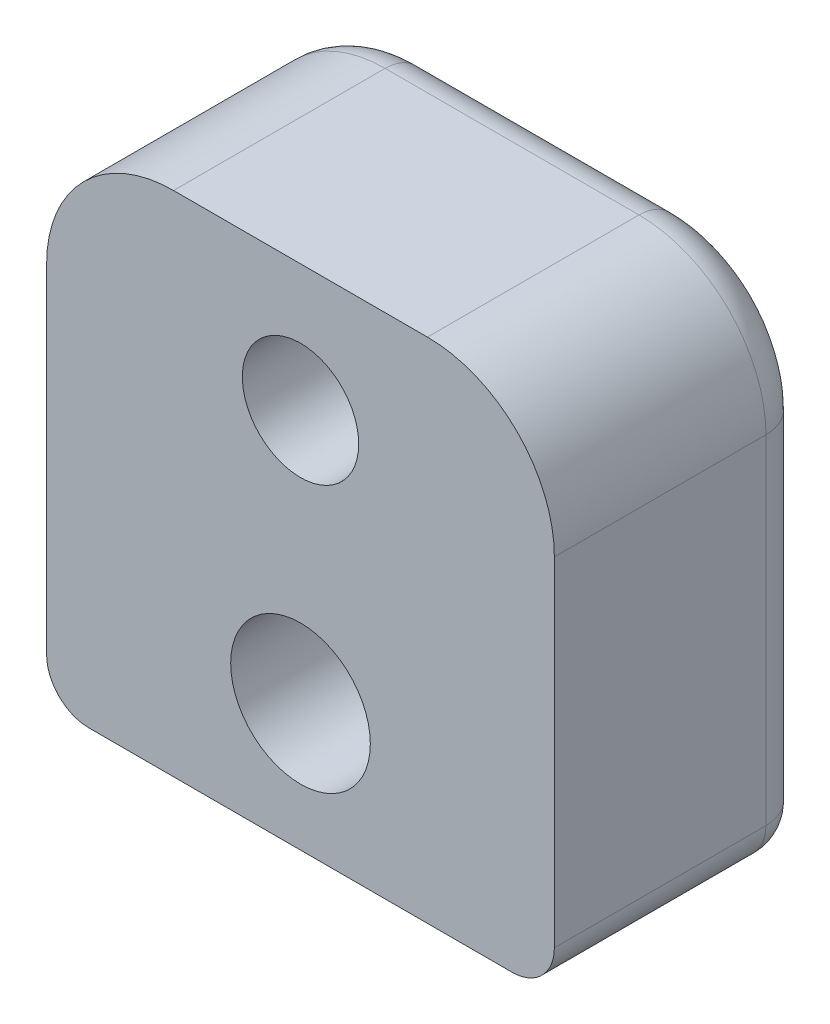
SolidWorks part; units mm, degrees
ref_plane "Front Plane" through (0, 0, 0) normal (0, 0, 1) x (1, 0, 0)
ref_plane "Top Plane" through (0, 0, 0) normal (0, 1, 0) x (1, 0, 0)
ref_plane "Right Plane" through (0, 0, 0) normal (1, 0, 0) x (0, 0, -1)
sketch "Sketch1" plane through (0, 0, 0) normal (0, 0, 1) x (1, 0, 0)
  line L0 (0.8125, -14.1875) -> (0.8125, 9.8125) construction
  line L1 (-5.1875, 9.8125) -> (6.8125, 9.8125)
  line L2 (-11.1875, 3.8125) -> (-11.1875, -12.1875)
  line L3 (-9.1875, -14.1875) -> (10.8125, -14.1875)
  line L4 (12.8125, 3.8125) -> (12.8125, -12.1875)
  line L5 (-11.1875, -8.1875) -> (12.8125, -8.1875) construction
  line L6 (-11.1875, 3.8125) -> (12.8125, 3.8125) construction
  arc A0 (6.8125, 9.8125) -> (12.8125, 3.8125) centre (6.8125, 3.8125) cw
  arc A1 (-5.1875, 9.8125) -> (-11.1875, 3.8125) centre (-5.1875, 3.8125) ccw
  arc A2 (10.8125, -14.1875) -> (12.8125, -12.1875) centre (10.8125, -12.1875) ccw
  arc A3 (-11.1875, -12.1875) -> (-9.1875, -14.1875) centre (-9.1875, -12.1875) ccw
  circle A4 centre (0.8125, -8.1875) radius 3.3
  circle A5 centre (0.8125, 3.8125) radius 2.75
  dimension "D3" = 6
  dimension "D4" = 2
  dimension "D7" = 5.5
  dimension "D8" = 6.6
  dimension "D1" = 24
  dimension "D2" = 24
  dimension "D5" = 6
  dimension "D6" = 12
extrude "Boss-Extrude1" add sketch "Sketch1" along normal blind 12
fillet "Fillet1" radius 2 8 edges at (0.8125, 9.8125, 0) (-9.4301, 8.0551, 0) (-11.1875, -4.1875, 0) (-10.6017, -13.6017, 0) (0.8125, -14.1875, 0) (12.2267, -13.6017, 0) (12.8125, -4.1875, 0) (11.0551, 8.0551, 0)
sketch "Sketch3" plane through (0, 0, 0) normal (0, 0, -1) x (-1, 0, 0)
  circle A0 centre (-0.8125, -8.1875) radius 5.5
extrude "Cut-Extrude1" cut sketch "Sketch3" against normal blind 7
